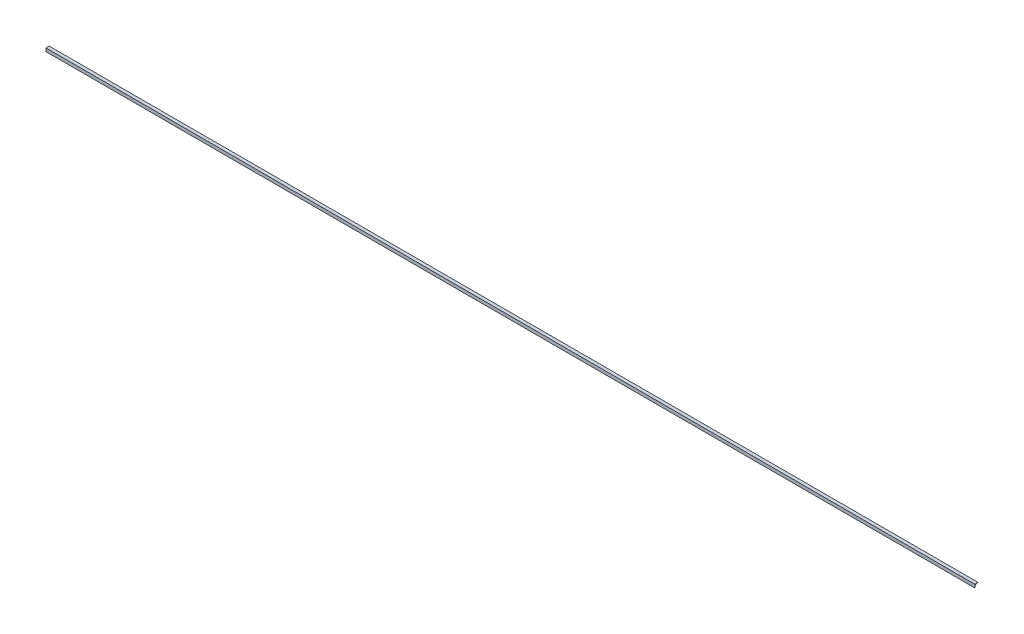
SolidWorks part; units mm, degrees
ref_plane "Front Plane" through (0, 0, 0) normal (1, 0, 0) x (0, 1, 0)
ref_plane "Top Plane" through (0, 0, 0) normal (0, 0, 1) x (0, 1, 0)
ref_plane "Right Plane" through (0, 0, 0) normal (0, 1, 0) x (-1, 0, 0)
sketch "Sketch1" plane through (0, 0, 0) normal (1, 0, 0) x (0, 1, 0)
  line L0 (76.2, 76.2) -> (74.6125, 76.2)
  line L1 (74.6125, 76.2) -> (74.9222, 76.1695)
  line L2 (74.9222, 76.1695) -> (75.22, 76.0792)
  line L3 (75.22, 76.0792) -> (75.4945, 75.9325)
  line L4 (75.4945, 75.9325) -> (75.735, 75.735)
  line L5 (75.735, 75.735) -> (75.9325, 75.4945)
  line L6 (75.9325, 75.4945) -> (76.0792, 75.22)
  line L7 (76.0792, 75.22) -> (76.1695, 74.9222)
  line L8 (76.1695, 74.9222) -> (76.2, 74.6125)
  line L9 (76.2, 74.6125) -> (76.2, 76.2)
extrude "Applied_corner_caulk" add sketch "Sketch1" along normal blind 457.2
